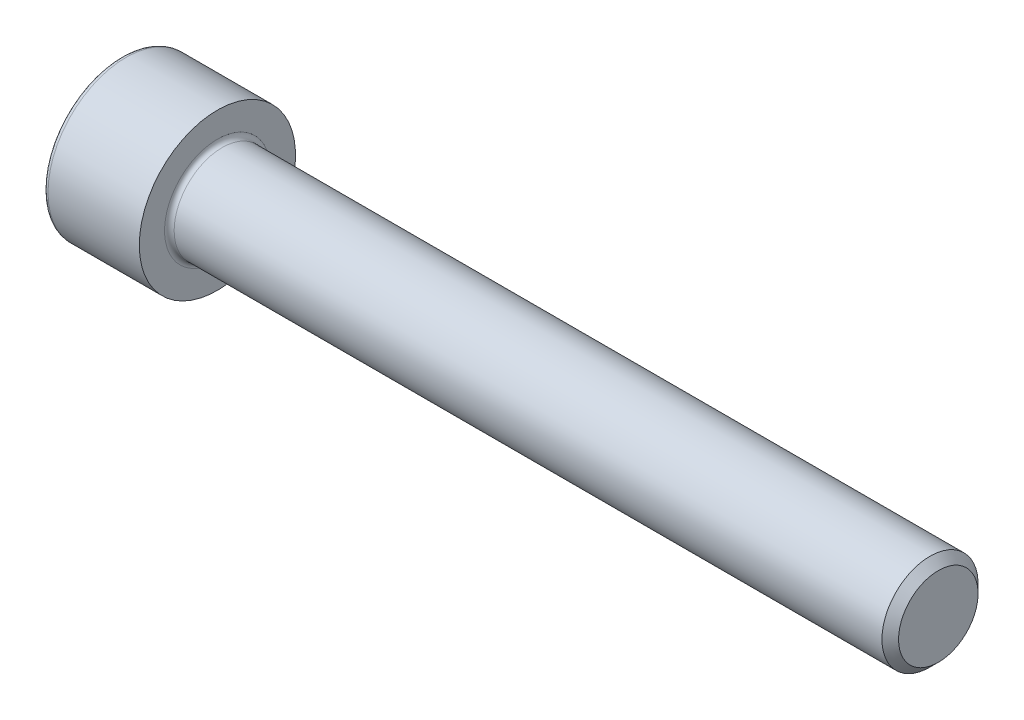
SolidWorks part; units mm, degrees
ref_plane "Plane1" through (0, 0, 0) normal (0, 0, 1) x (1, 0, 0)
ref_plane "Plane2" through (0, 0, 0) normal (0, 1, 0) x (1, 0, 0)
ref_plane "Plane3" through (0, 0, 0) normal (1, 0, 0) x (0, 0, -1)
revolve "Base-Revolve" add sketch "BodySke"
sketch "BodySke" plane through (0, 0, 0) normal (0, 0, 1) x (1, 0, 0)
  line L0 (0, 0) -> (0, 6.5)
  line L1 (0, 6.5) -> (8, 6.5)
  line L2 (8, 6.5) -> (8, 4)
  line L3 (8, 4) -> (67.3095, 4)
  line L4 (68, 3.3095) -> (68, 0)
  line L5 (68, 0) -> (0, 0)
  line L6 (-31.75, 0) -> (127, 0) construction
  line L8 (68, 3.3095) -> (67.3095, 4)
  line L10 (68, -3.3095) -> (67.3095, -4) construction
  line L11 (9.25, 9.525) -> (9.25, 3.175) construction
  line L12 (8, 9.525) -> (8, 3.175) construction
  line L13 (8, 9.525) -> (8, 3.175) construction
  dimension "Diameter" = 8
  dimension "Head_ht" = 8
  dimension "Length" = 60
  dimension "Body_ch_ang" = 45
  dimension "Head_dia" = 13
  dimension "Minor_dia" = 6.619
  dimension "Advance" = 1.25
  dimension "Thread_nom" = 60
  dimension "Thread_length" = 60
fillet "Fillet1" radius 0.4 1 edges at (8, 0, 4)
fillet "Fillet2" radius 0.4 1 edges at (0, 0, 6.5)
sketch "Sketch2" plane through (0, 0, 0) normal (0, 0, 1) x (1, 0, 0)
  line L0 (0, 3.0475) -> (4, 3.0475)
  line L1 (4, 3.0475) -> (5.7595, 0)
  line L2 (-31.75, 0) -> (127, 0) construction
  line L3 (5.7595, 0) -> (0, 0)
  line L4 (0, 0) -> (0, 3.0475)
  line L6 (0, 0) -> (47.625, 0) construction
  dimension "D1" = 3.0475
  dimension "D2" = 60
  dimension "Depth" = 4
revolve "Hex-PreBroach" cut sketch "Sketch2" angle 360 about L6
sketch "Sketch3" plane through (0, 0, 0) normal (-1, 0, 0) x (0, 0.5, 0.866)
  line L0 (1.7595, 3.0475) -> (-1.7595, 3.0475)
  line L1 (-1.7595, 3.0475) -> (-3.5189, 0)
  line L2 (1.7595, 3.0475) -> (3.5189, 0)
  line L3 (1.7595, -3.0475) -> (3.5189, 0)
  line L4 (1.7595, -3.0475) -> (-1.7595, -3.0475)
  line L5 (-1.7595, -3.0475) -> (-3.5189, 0)
  dimension "D1" = 3.0475
  dimension "D2" = 3.0475
  dimension "Hex_size" = 6.095
extrude "Hex" cut sketch "Sketch3" against normal blind 4
sketch "ThdSchSke" plane through (0, 0, 0) normal (0, 0, 1) x (1, 0, 0)
  line L0 (11.75, -3.3095) -> (11.2665, -4)
  line L1 (11.75, -3.3095) -> (12.2335, -4)
  line L2 (12.2335, -4) -> (12.2335, -5)
  line L3 (-3.175, 0) -> (5.1513, 0) construction
  line L4 (0, 6.1) -> (0, -6.1) construction
  line L5 (12.2335, -5) -> (11.2665, -5)
  line L6 (11.2665, -5) -> (11.2665, -4)
  dimension "Thread_minor" = 6.619
  dimension "Diameter" = 8
  dimension "Start" = 11.75
  dimension "SideAngle" = 55
  dimension "VeeAngle" = 70
  dimension "Overcut" = 10
revolve "ThreadSchematic" [suppressed] cut sketch "ThdSchSke" angle 360 about L3
pattern_linear "ThdSchPat" [suppressed]
equation "\"D2@Sketch3\" = \"Hex_size@Sketch3\" / 2"
equation "\"D1@Sketch3\" = \"Hex_size@Sketch3\" / 2"
equation "\"D1@Sketch2\" = \"Hex_size@Sketch3\" / 2"
equation "\"Thread_minor@ThreadCosmetic\"  =  \"Minor_dia@BodySke\""
equation "\"Depth@Sketch2\" =  \"Key_eng@Hex\""
equation "\"Thread_length@ThreadCosmetic\" = ((sgn( (\"Length@BodySke\" - \"Advance@BodySke\" * 3.0) - \"Thread_nom@BodySke\" )-1)*( (\"Length@BodySke\" - \"Advance@BodySke\" * 3.0) - \"Thread_nom@BodySke\" ))/-2+ \"Thread_no"
equation "\"Thread_minor@ThdSchSke\" = \"Minor_dia@BodySke\""
equation "\"Diameter@ThdSchSke\" = \"Diameter@BodySke\""
equation "\"Overcut@ThdSchSke\" = \"Diameter@BodySke\" * 1.25"
equation "\"Start@ThdSchSke\" = \"Head_ht@BodySke\" + \"Length@BodySke\" - \"Thread_length@ThreadCosmetic\"  '---Non-countersunk---"
equation "\"Num_threads@ThdSchPat\" = int( \"Thread_length@ThreadCosmetic\" / \"Advance@BodySke\" + 0.999 )  + 1"
equation "\"Advance@ThdSchPat\" = \"Thread_length@ThreadCosmetic\" /  (\"Num_threads@ThdSchPat\" - 1) 'relax it"
equation "\"Num_threads@ThdSchPat\" = \"Num_threads@ThdSchPat\" - sgn( \"Num_threads@ThdSchPat\" - 1) '---chamfered tips only---"
